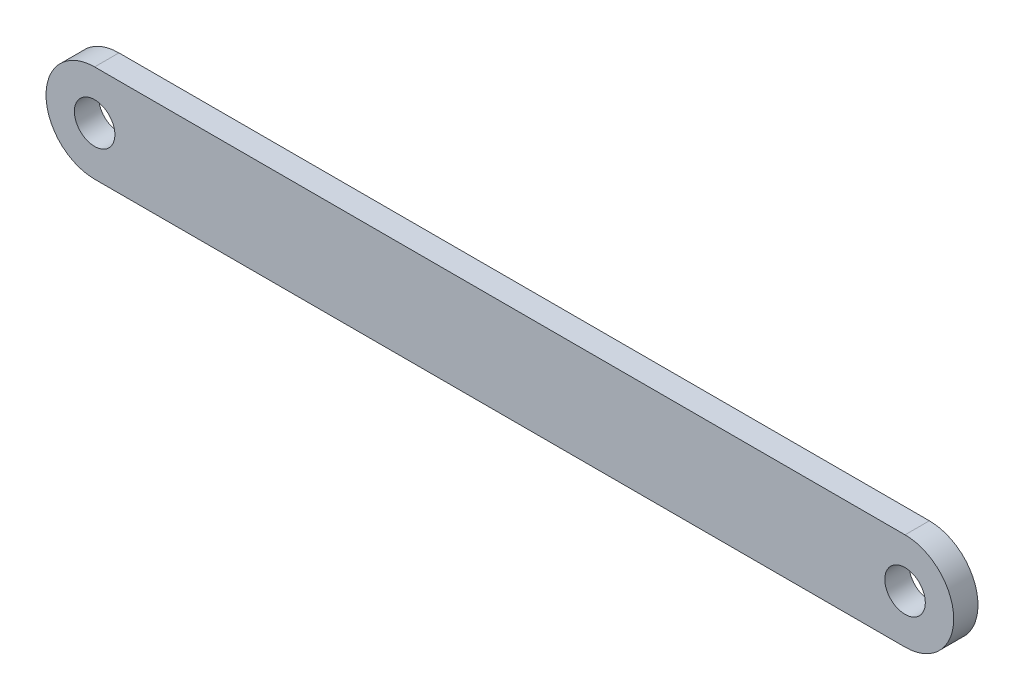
SolidWorks part; units mm, degrees
ref_plane "Alzado" through (0, 0, 0) normal (0, 0, 1) x (1, 0, 0)
ref_plane "Planta" through (0, 0, 0) normal (0, 1, 0) x (1, 0, 0)
ref_plane "Vista lateral" through (0, 0, 0) normal (1, 0, 0) x (0, 0, -1)
sketch "Croquis1" plane through (0, 0, 0) normal (0, 0, 1) x (1, 0, 0)
  line L0 (0, 0) -> (0, 40921.9618) construction
  line L1 (0, 0) -> (40921.9618, 0) construction
  line L2 (-50, 6) -> (50, 6)
  line L3 (-50, 6) -> (50, 6) construction
  line L4 (-50, 6) -> (-50, -6) construction
  line L5 (-50, -6) -> (50, -6) construction
  line L6 (50, 6) -> (50, -6) construction
  line L7 (-50, 6) -> (50, -6) construction
  line L8 (-50, -6) -> (50, 6) construction
  line L9 (50, -6) -> (-50, -6)
  arc A0 (-50, 6) -> (-50, -6) centre (-50, 0) ccw
  arc A1 (50, 6) -> (50, -6) centre (50, 0) cw
  circle A2 centre (50, 0) radius 2.5
  circle A3 centre (-50, 0) radius 2.5
  point P5 (0, 0)
  dimension "D3" = 5
  dimension "D4" = 5
  dimension "D1" = 12
  dimension "D2" = 100
extrude "Saliente-Extruir1" add sketch "Croquis1" along normal mid plane 3
